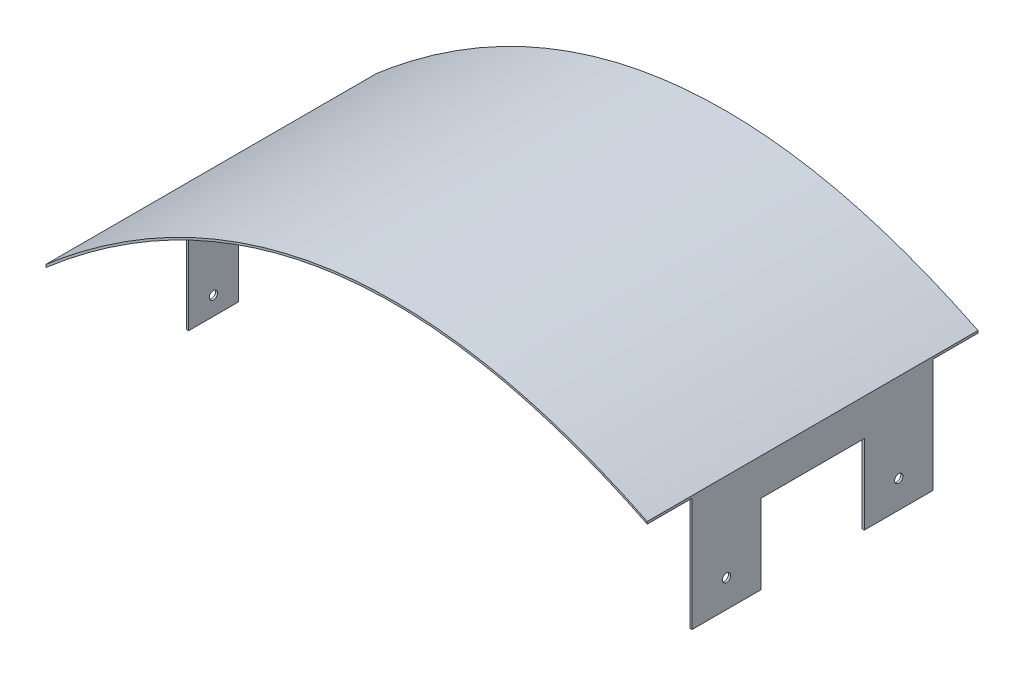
SolidWorks part; units mm, degrees
ref_plane "Front Plane" through (0, 0, 0) normal (0, 0, 1) x (1, 0, 0)
ref_plane "Top Plane" through (0, 0, 0) normal (0, 1, 0) x (1, 0, 0)
ref_plane "Right Plane" through (0, 0, 0) normal (1, 0, 0) x (0, 0, -1)
sketch3d "3DSketch3"
  line L5 (-45.25, 34.4, 12.3284) -> (-45.25, 34.4, 20)
  line L6 (-45.25, 32.4, 5.5) -> (-45.25, 32.4, 9.5)
  line L7 (-45.25, 34.4, -2.6716) -> (-45.25, 34.4, 2.6716)
  line L8 (-45.25, 32.4, -9.5) -> (-45.25, 32.4, -5.5)
  line L9 (-45.25, 34.4, -20) -> (-45.25, 34.4, -12.3284)
  circle A16 centre (-45.25, 30.9, 15) radius 0.6
  circle A17 centre (-45.25, 30.9, 0) radius 0.6
  circle A18 centre (-45.25, 30.9, -15) radius 0.6
  arc A19 (-45.25, 34.4, 20) -> (-45.25, 30.4, 24) centre (-45.25, 30.4, 20) ccw
  arc A20 (-45.25, 33.7333, 11.3856) -> (-45.25, 34.4, 12.3284) centre (-45.25, 33.4, 12.3284) ccw
  arc A21 (-45.25, 32.4, 9.5) -> (-45.25, 33.7333, 11.3856) centre (-45.25, 34.4, 9.5) ccw
  arc A22 (-45.25, 33.7333, 3.6144) -> (-45.25, 32.4, 5.5) centre (-45.25, 34.4, 5.5) ccw
  arc A23 (-45.25, 34.4, 2.6716) -> (-45.25, 33.7333, 3.6144) centre (-45.25, 33.4, 2.6716) ccw
  arc A24 (-45.25, 32.4, -5.5) -> (-45.25, 33.7333, -3.6144) centre (-45.25, 34.4, -5.5) ccw
  arc A25 (-45.25, 33.7333, -11.3856) -> (-45.25, 32.4, -9.5) centre (-45.25, 34.4, -9.5) ccw
  arc A26 (-45.25, 34.4, -12.3284) -> (-45.25, 33.7333, -11.3856) centre (-45.25, 33.4, -12.3284) ccw
  arc A27 (-45.25, 30.4, -24) -> (-45.25, 34.4, -20) centre (-45.25, 30.4, -20) ccw
  arc A28 (42, 45.1, 17.5) -> (42, 37.667, 24) centre (42, 45.1, 25) ccw
  circle A29 centre (42, 45.1, -12.5) radius 0.4
  arc A30 (42, 45.1, -7.5) -> (42, 45.1, 7.5) centre (42, 45.1, 0) ccw
  arc A31 (42, 37.667, -24) -> (42, 45.1, -17.5) centre (42, 45.1, -25) ccw
  arc A33 (-45.25, 33.7333, -3.6144) -> (-45.25, 34.4, -2.6716) centre (-45.25, 33.4, -2.6716) ccw
  circle A35 centre (42, 45.1, 12.5) radius 0.4
  spline S2 degree 3 poles (42, 45.1, 7.5) (42, 57.6, 7.5) (42, 57.6, 17.5) (42, 45.1, 17.5) knots 0 0 0 0 1 1 1 1 weights 1 0.333333 0.333333 1
  spline S3 degree 3 poles (42, 45.1, -17.5) (42, 57.6, -17.5) (42, 57.6, -7.5) (42, 45.1, -7.5) knots 0 0 0 0 1 1 1 1 weights 1 0.333333 0.333333 1
  point P17 (-44.65, 30.9, 15)
  point P24 (-44.65, 30.9, 0)
  point P31 (-44.65, 30.9, -15)
  point P34 (-41.25, 30.4, 20)
  point P40 (-44.25, 33.4, 12.3284)
  point P43 (-47.25, 34.4, 9.5)
  point P47 (-47.25, 34.4, 5.5)
  point P50 (-44.25, 33.4, 2.6716)
  point P53 (-47.25, 34.4, -5.5)
  point P60 (-47.25, 34.4, -9.5)
  point P66 (-44.25, 33.4, -12.3284)
  point P69 (-41.25, 30.4, -20)
  point P72 (34.5, 45.1, 25)
  point P75 (41.6, 45.1, -12.5)
  point P76 (34.5, 45.1, 0)
  point P77 (34.5, 45.1, -25)
  point P82 (-44.25, 33.4, -2.6716)
  point P85 (41.6, 45.1, 12.5)
ref_plane "Plane1" through (-45.25, 0, 0) normal (-1, 0, 0) x (0, 0, 1)
ref_plane "Plane2" through (42, 0, 0) normal (1, 0, 0) x (0, 0, -1)
sketch "Sketch1" plane through (-45.25, 0, 0) normal (-1, 0, 0) x (0, 0, 1)
  line L0 (-3.6144, 33.7333) -> (-3.6144, 28.2333)
  line L1 (0, 30.9) -> (0, 25.9117) construction
  line L2 (-3.6144, 28.2333) -> (0, 28.2333)
  line L3 (-3.6144, 33.7333) -> (-3.6144, 46.2333)
  line L4 (-24, 30.4) -> (-24, 54.5742) construction
  line L5 (-3.6144, 46.2333) -> (-24, 46.2333) construction
  line L6 (3.6144, 28.2333) -> (0, 28.2333)
  line L7 (3.6144, 33.7333) -> (3.6144, 28.2333)
  line L8 (3.6144, 33.7333) -> (3.6144, 46.2333)
  line L9 (3.6144, 46.2333) -> (24, 46.2333) construction
  line L10 (-3.6144, 46.2333) -> (3.6144, 46.2333)
  circle A0 centre (0, 30.9) radius 0.6
  dimension "D3" = 1.2
  dimension "D1" = 5.5
  dimension "D2" = 12.5
sketch "Sketch2" plane through (42, 0, 0) normal (1, 0, 0) x (0, 0, -1)
  line L0 (7.5, 45.1) -> (7.5, 37.2204) construction
  line L1 (17.5, 45.1) -> (17.5, 37.5931) construction
  line L2 (17.5, 37.5931) -> (17.5, 58.1374) construction
  line L3 (7.5, 45.1) -> (7.5, 57.8474) construction
  line L4 (0, 45.1) -> (0, 58.1374) construction
  line L5 (17.5, 45.1) -> (17.5, 41.1)
  line L6 (17.5, 41.1) -> (7.5, 41.1)
  line L7 (7.5, 41.1) -> (7.5, 45.1)
  line L8 (7.5, 45.1) -> (7.5, 52.6)
  line L9 (7.5, 52.6) -> (0, 52.6)
  line L10 (17.5, 45.1) -> (17.5, 57.6)
  line L11 (17.5, 57.6) -> (24, 57.6) construction
  line L12 (24, 30.4) -> (24, 54.5742) construction
  line L16 (-17.5, 57.6) -> (-24, 57.6) construction
  line L17 (-17.5, 45.1) -> (-17.5, 57.6)
  line L18 (-17.5, 45.1) -> (-17.5, 41.1)
  line L19 (-17.5, 41.1) -> (-7.5, 41.1)
  line L20 (-7.5, 41.1) -> (-7.5, 45.1)
  line L21 (-7.5, 45.1) -> (-7.5, 52.6)
  line L22 (-7.5, 52.6) -> (0, 52.6)
  line L24 (-17.5, 57.6) -> (17.5, 57.6)
  circle A0 centre (-12.5, 45.1) radius 0.6
  circle A1 centre (12.5, 45.1) radius 0.6
  dimension "D4" = 1.2
  dimension "D5" = 1.2
  dimension "D1" = 4
  dimension "D2" = 12.5
  dimension "D3" = 7.5
ref_plane "Plane3" through (0, 0, -24) normal (0, 0, 1) x (1, 0, 0)
sketch "Sketch6" plane through (0, 0, -24) normal (0, 0, 1) x (1, 0, 0)
  spline S0 degree 2 poles (-45.25, 46.2333) (-5.0838, 80.8869) (42, 57.6) knots 0 0 0 1 1 1
ref_plane "Plane4" through (0, 0, 24) normal (0, 0, 1) x (1, 0, 0)
sketch "Sketch7" plane through (0, 0, 24) normal (0, 0, 1) x (1, 0, 0)
  line L0 (-45.25, 46.6292) -> (-45.25, 46.2333)
  line L1 (-45.25, 30.4) -> (-45.25, 54.5742) construction
  line L2 (42, 57.6) -> (42, 57.9346)
  line L3 (42, 45.1) -> (42, 58.1374) construction
  spline S0 degree 2 poles (-45.25, 46.2333) (-5.0838, 80.8869) (42, 57.6) knots 0 0 0 1 1 1
  spline S1 degree 1 poles (-45.446, 46.4605) (42.133, 57.8689) knots 0 0 1 1 construction
  spline S2 degree 2 poles (-45.446, 46.4605) (-30.3449, 59.493) (-3.5019, 67.6089) (24.4286, 66.6285) (42.133, 57.8689) knots 0 0 0 0.375 0.625 1 1 1 only from (-45.25, 46.6292) to (42, 57.9346)
  dimension "D1" = 0.3
sketch3d "3DSketch4"
  line L0 (42, 45.1, 17.5) -> (42, 41.1, 17.5) construction
  line L1 (42, 41.1, 17.5) -> (42, 41.1, 7.5) construction
  line L2 (42, 41.1, 7.5) -> (42, 45.1, 7.5) construction
  line L3 (42, 45.1, 7.5) -> (42, 52.6, 7.5) construction
  line L4 (42, 52.6, 7.5) -> (42, 52.6, 0) construction
  line L5 (42, 52.6, -7.5) -> (42, 52.6, 0) construction
  line L6 (42, 41.1, -7.5) -> (42, 45.1, -7.5) construction
  line L7 (42, 45.1, -7.5) -> (42, 52.6, -7.5) construction
  line L8 (42, 41.1, -17.5) -> (42, 41.1, -7.5) construction
  line L9 (42, 45.1, -17.5) -> (42, 41.1, -17.5) construction
  line L10 (42, 45.1, -17.5) -> (42, 57.6, -17.5) construction
  line L11 (42, 57.6, -17.5) -> (42, 57.6, -24) construction
  line L12 (42, 45.1, 17.5) -> (42, 57.6, 17.5) construction
  line L13 (42, 57.6, 17.5) -> (42, 57.6, 24) construction
  line L14 (-45.25, 46.2333, -3.6144) -> (-45.25, 46.2333, -24) construction
  line L15 (-45.25, 46.2333, 3.6144) -> (-45.25, 46.2333, 24) construction
  line L16 (-45.25, 33.7333, 3.6144) -> (-45.25, 46.2333, 3.6144) construction
  line L17 (-45.25, 33.7333, 3.6144) -> (-45.25, 28.2333, 3.6144) construction
  line L18 (-45.25, 33.7333, -3.6144) -> (-45.25, 46.2333, -3.6144) construction
  line L19 (-45.25, 33.7333, -3.6144) -> (-45.25, 28.2333, -3.6144) construction
  line L20 (-45.25, 28.2333, -3.6144) -> (-45.25, 28.2333, 0) construction
  line L21 (-45.25, 28.2333, 3.6144) -> (-45.25, 28.2333, 0) construction
  line L22 (42, 45.1, 17.5) -> (42, 41.1, 17.5)
  line L23 (42, 41.1, 17.5) -> (42, 41.1, 7.5)
  line L24 (42, 41.1, 7.5) -> (42, 45.1, 7.5)
  line L25 (42, 45.1, 7.5) -> (42, 52.6, 7.5)
  line L26 (42, 52.6, 7.5) -> (42, 52.6, 0)
  line L27 (42, 52.6, -7.5) -> (42, 52.6, 0)
  line L28 (42, 41.1, -7.5) -> (42, 45.1, -7.5)
  line L29 (42, 45.1, -7.5) -> (42, 52.6, -7.5)
  line L30 (42, 41.1, -17.5) -> (42, 41.1, -7.5)
  line L31 (42, 45.1, -17.5) -> (42, 41.1, -17.5)
  line L32 (42, 45.1, -17.5) -> (42, 57.6, -17.5)
  line L33 (42, 57.6, -17.5) -> (42, 57.6, -24)
  line L34 (42, 45.1, 17.5) -> (42, 57.6, 17.5)
  line L35 (42, 57.6, 17.5) -> (42, 57.6, 24)
  line L36 (-45.25, 46.2333, -3.6144) -> (-45.25, 46.2333, -24)
  line L37 (-45.25, 46.2333, 3.6144) -> (-45.25, 46.2333, 24)
  line L38 (-45.25, 33.7333, 3.6144) -> (-45.25, 46.2333, 3.6144)
  line L39 (-45.25, 33.7333, 3.6144) -> (-45.25, 28.2333, 3.6144)
  line L40 (-45.25, 33.7333, -3.6144) -> (-45.25, 46.2333, -3.6144)
  line L41 (-45.25, 33.7333, -3.6144) -> (-45.25, 28.2333, -3.6144)
  line L42 (-45.25, 28.2333, -3.6144) -> (-45.25, 28.2333, 0)
  line L43 (-45.25, 28.2333, 3.6144) -> (-45.25, 28.2333, 0)
  circle A0 centre (42, 45.1, 12.5) radius 0.4 construction
  circle A1 centre (42, 45.1, -12.5) radius 0.4 construction
  circle A2 centre (-45.25, 30.9, 0) radius 0.6 construction
  circle A3 centre (42, 45.1, 12.5) radius 0.4
  circle A4 centre (42, 45.1, -12.5) radius 0.4
  circle A5 centre (-45.25, 30.9, 0) radius 0.6
  spline S0 degree 2 poles (-276.5328, -1933.3546, -24) (-234.2186, 2005.3081, -24) (734.0253, -1811.344, -24) knots -5.277587 -5.277587 -5.277587 6.29175 6.29175 6.29175 only from (-45.25, 46.2333, -24) to (42, 57.6, -24) construction
  spline S1 degree 2 poles (-276.5328, -1933.3546, 24) (-234.2186, 2005.3081, 24) (734.0253, -1811.344, 24) knots -5.277587 -5.277587 -5.277587 6.29175 6.29175 6.29175 only from (-45.25, 46.2333, 24) to (42, 57.6, 24) construction
  spline S2 degree 2 poles (-45.25, 46.2333, -24) (-5.0838, 80.8869, -24) (42, 57.6, -24) knots 0 0 0 1 1 1
  spline S3 degree 2 poles (-45.25, 46.2333, 24) (-5.0838, 80.8869, 24) (42, 57.6, 24) knots 0 0 0 1 1 1
  point P4 (41.6, 45.1, 12.5)
  point P7 (41.6, 45.1, 12.5)
  point P11 (41.6, 45.1, -12.5)
  point P17 (-44.65, 30.9, 0)
  point P21 (41.6, 45.1, -12.5)
  point P48 (-44.65, 30.9, 0)
extrude "Boss-Extrude1" add sketch "Sketch7" against normal up to surface (48 mm away)
extrude "Boss-Extrude2" add sketch "Sketch1" against normal blind 0.3 separate body
sketch "Sketch8" plane through (0, 46.2333, 0) normal (0, 1, 0) x (1, 0, 0)
  line L4 (-45.25, 3.6144) -> (-45.25, -3.6144)
  line L5 (-45.25, -3.6144) -> (-44.95, -3.6144)
  line L6 (-44.95, -3.6144) -> (-44.95, 3.6144)
  line L7 (-44.95, 3.6144) -> (-45.25, 3.6144)
  line L8 (-45.25, 3.6144) -> (-45.25, -3.6144)
  line L9 (-45.25, -3.6144) -> (-44.95, -3.6144)
  line L10 (-44.95, -3.6144) -> (-44.95, 3.6144)
  line L11 (-44.95, 3.6144) -> (-45.25, 3.6144)
  dimension "D1" = 0
extrude "Boss-Extrude3" add sketch "Sketch8" along normal up to surface (0.2579 mm away)
extrude "Boss-Extrude4" add sketch "Sketch2" against normal blind 0.3 separate body
sketch "Sketch9" plane through (0, 57.6, 0) normal (0, 1, 0) x (1, 0, 0)
  line L4 (42, -17.5) -> (42, 17.5)
  line L5 (42, 17.5) -> (41.7, 17.5)
  line L6 (41.7, 17.5) -> (41.7, -17.5)
  line L7 (41.7, -17.5) -> (42, -17.5)
  line L8 (42, -17.5) -> (42, 17.5)
  line L9 (42, 17.5) -> (41.7, 17.5)
  line L10 (41.7, 17.5) -> (41.7, -17.5)
  line L11 (41.7, -17.5) -> (42, -17.5)
  dimension "D1" = 0
extrude "Boss-Extrude5" add sketch "Sketch9" along normal up to surface (0.1478 mm away)
surface "Surface-Flatten2"
